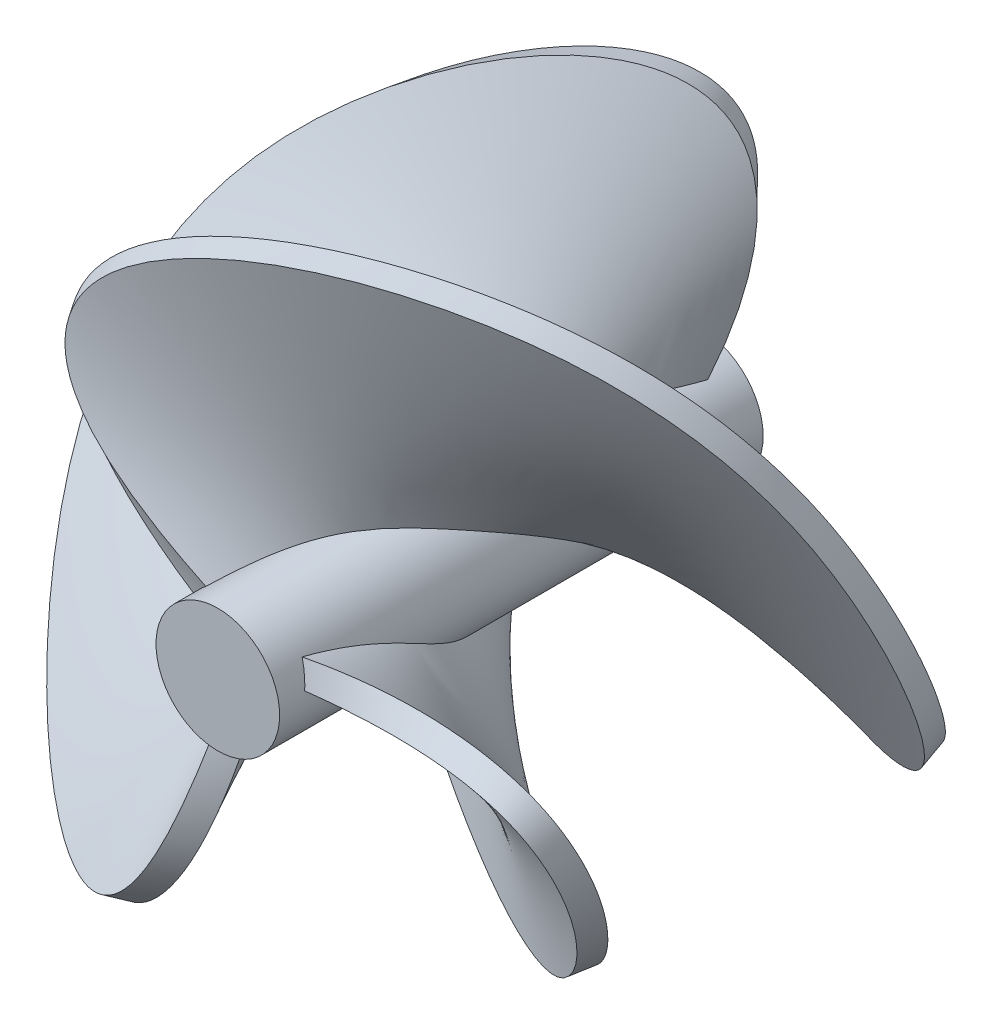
SolidWorks part; units mm, degrees
ref_plane "Ebene vorne" through (0, 0, 0) normal (0, 0, 1) x (1, 0, 0)
ref_plane "Ebene oben" through (0, 0, 0) normal (0, 1, 0) x (1, 0, 0)
ref_plane "Ebene rechts" through (0, 0, 0) normal (1, 0, 0) x (0, 0, -1)
sketch "Skizze1" plane through (0, 0, 0) normal (0, 0, 1) x (1, 0, 0)
  circle A0 centre (0, 0) radius 25 construction
  dimension "D1" = 50
ref_plane "Ebene1" through (0, 0, 11) normal (0, 0, 1) x (1, 0, 0)
ref_plane "Ebene2" through (0, 0, 22) normal (0, 0, 1) x (1, 0, 0)
ref_plane "Ebene3" through (0, 0, 33) normal (0, 0, 1) x (1, 0, 0)
sketch "Skizze2" plane through (0, 0, 0) normal (0, 1, 0) x (1, 0, 0)
  line L0 (0, 0) -> (0, -33) construction
  dimension "D1" = 33
sketch "Skizze3" plane through (0, 0, 0) normal (0, 0, 1) x (1, 0, 0)
  line L0 (0, 0) -> (0, 25) construction
  circle A0 centre (0, 0) radius 25 construction
sketch "Skizze4" plane through (0, 0, 11) normal (0, 0, 1) x (1, 0, 0)
  line L0 (0, 0) -> (-19.7841, 15.2836) construction
  line L2 (0, 0) -> (0, 25) construction
  circle A0 centre (0, 0) radius 25 construction
  dimension "D1" = 52.313
sketch "Skizze5" plane through (0, 0, 22) normal (0, 0, 1) x (1, 0, 0)
  line L0 (0, 0) -> (-24.8433, -2.7947) construction
  line L1 (0, 0) -> (0, 25) construction
  circle A0 centre (0, 0) radius 25 construction
  dimension "D1" = 96.418
sketch "Skizze6" plane through (0, 0, 33) normal (0, 0, 1) x (1, 0, 0)
  line L0 (0, 0) -> (-14.3861, -20.446) construction
  line L1 (0, 0) -> (0, 25) construction
  circle A0 centre (0, 0) radius 25 construction
  dimension "D1" = 144.869
sketch3d "3D-Skizze1"
  line L0 (0, 0, 0) -> (0, 0, 33)
  spline S0 degree 3 poles (0, 0, 0) (16.3099, 34.3706, -6.4385) (-20.6391, 23.9769, 6.5953) (-29.5764, -9.52, 26.0696) (-6.2879, -36.3578, 40.0179) (0, 0, 33) knots 0 0 0 0 0.414751 0.596568 1 1 1 1
surface "Oberflächenausfüllung1" sketch "3D-Skizze1"
thicken "Wanddicke auftragen1" surfaces to thicken 103 thickness 1 thickness side both sides parameters "D1"=1
sketch "Skizze7" plane through (0, 0, 0) normal (0, 0, 1) x (1, 0, 0)
  circle A0 centre (0, 0) radius 5
  dimension "D1" = 10
extrude "Aufsatz-Linear austragen1" add sketch "Skizze7" along normal through all and the other way through all
pattern_circular "Kreismuster1" count 3 over 360 about axis through (0, 0, 36.1712) along (0, 0, -1)
combine bodies "Kombinieren1" operation type add bodies to combine 105 108 109
